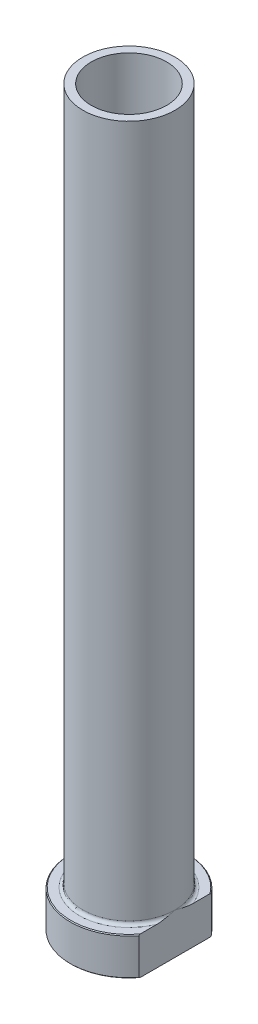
SolidWorks part; units mm, degrees
ref_plane "Front Plane" through (0, 0, 0) normal (0, 0, 1) x (1, 0, 0)
ref_plane "Top Plane" through (0, 0, 0) normal (0, 1, 0) x (1, 0, 0)
ref_plane "Right Plane" through (0, 0, 0) normal (1, 0, 0) x (0, 0, -1)
sketch "Sketch1" plane through (0, 0, 0) normal (0, 0, 1) x (1, 0, 0)
  line L0 (-9, 175) -> (-11, 175)
  line L1 (-11, 175) -> (-11, 9)
  line L2 (-11, 9) -> (-14, 9)
  line L3 (-14, 9) -> (-14, 0)
  line L4 (13.75, 0) -> (-13.75, 0) construction
  line L5 (-14, 0) -> (-9.25, 0)
  line L6 (-9, 120) -> (-9, 175)
  line L7 (0, 92.1877) -> (0, -15.5353) construction
  line L8 (0, -15.4) -> (0, 15.4) construction
  line L9 (-9, 120) -> (-9.25, 108)
  line L10 (-9.25, 108) -> (-9.25, 0)
  dimension "D1" = 0.25
  dimension "ID" = 18
  dimension "OD" = 22
  dimension "L" = 175
  dimension "H" = 28
  dimension "T" = 9
  dimension "N" = 55
  dimension "D2" = 12
  dimension "L-N" = 120
revolve "Revolve1" add sketch "Sketch1" angle 360 about L7
fillet "Fillet1" radius 0.8 1 edges at (0, 9, 11)
chamfer "Chamfer1" distance 0.2 angle 45 2 edges at (0, 9, 14) (0, 0, 14)
sketch "Sketch2" plane through (0, 0, 0) normal (0, -1, 0) x (1, 0, 0)
  line L0 (11, 8.6603) -> (11, -8.6603)
  circle A0 centre (0, 0) radius 14 construction
  arc A1 (11, 8.6603) -> (11, -8.6603) centre (0, 0) cw
  circle A2 centre (0, 0) radius 11 construction
extrude "Cut-Extrude1" cut sketch "Sketch2" against normal through all
chamfer "Chamfer2" distance 0.5 angle 45 1 edges at (0, 0, 9.25)
